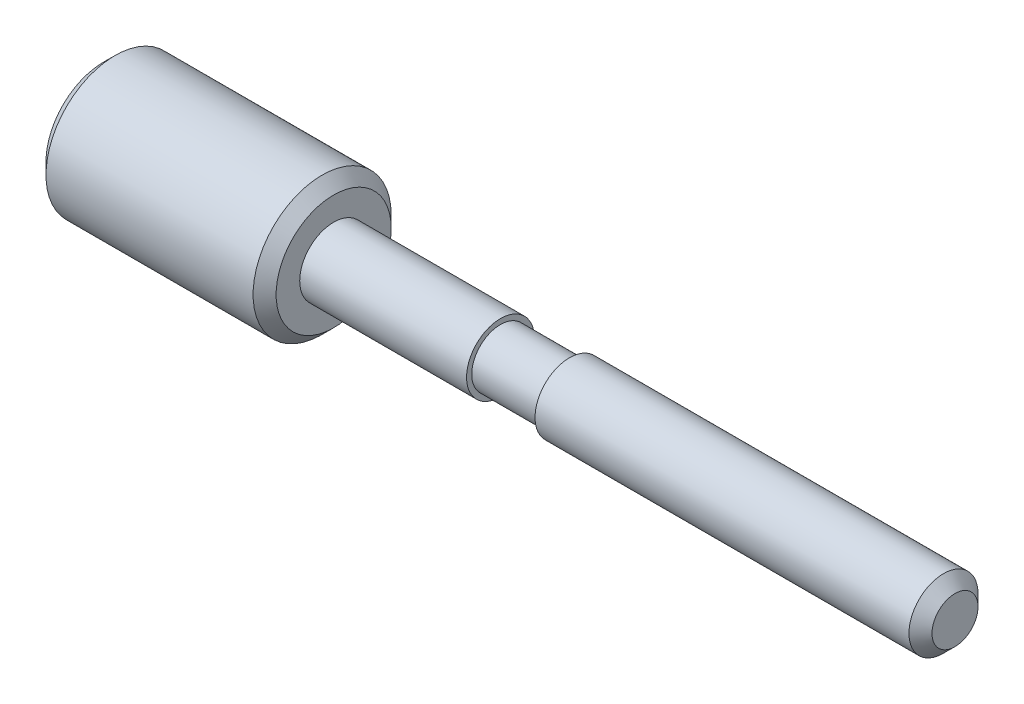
SolidWorks part; units mm, degrees
ref_plane "Face" through (0, 0, 0) normal (0, 0, 1) x (1, 0, 0)
ref_plane "Dessus" through (0, 0, 0) normal (0, 1, 0) x (1, 0, 0)
ref_plane "Droite" through (0, 0, 0) normal (1, 0, 0) x (0, 0, -1)
sketch "Esquisse1" plane through (0, 0, 0) normal (1, 0, 0) x (0, 0, -1)
  circle A0 centre (0, 0) radius 6
extrude "Base-Extrusion" add sketch "Esquisse1" along normal blind 20
sketch "Esquisse2" plane through (20, 0, 0) normal (1, 0, 0) x (0, 0, -1)
  circle A0 centre (0, 0) radius 2.95
extrude "Boss.-Extru.1" add sketch "Esquisse2" along normal blind 14.5
sketch "Esquisse3" plane through (34.5, 0, 0) normal (1, 0, 0) x (0, 0, -1)
  circle A0 centre (0, 0) radius 2.5
extrude "Boss.-Extru.3" add sketch "Esquisse3" along normal blind 6
sketch "Esquisse4" plane through (40.5, 0, 0) normal (1, 0, 0) x (0, 0, -1)
  circle A0 centre (0, 0) radius 3
extrude "Boss.-Extru.4" add sketch "Esquisse4" along normal blind 33.5
chamfer "Chanfrein1" distance 1 angle 45
chamfer "Chanfrein2" distance 1 angle 45
